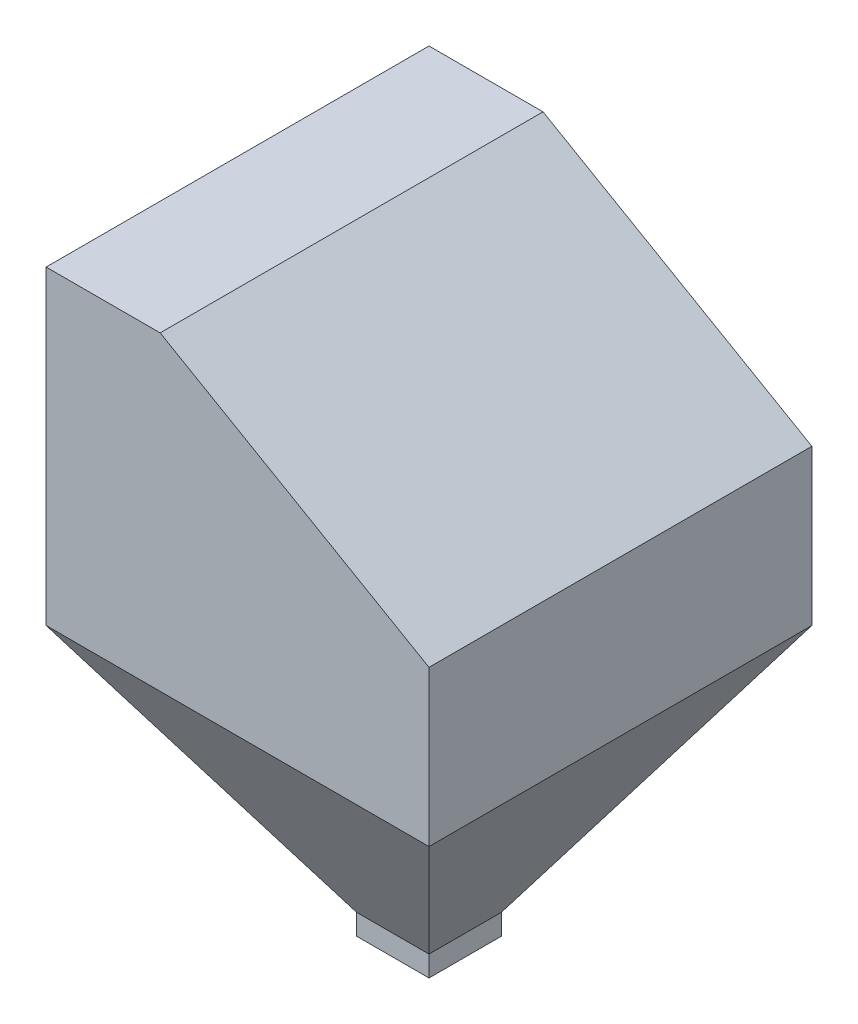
SolidWorks part; units mm, degrees
ref_plane "Front Plane" through (0, 0, 0) normal (0, 0, 1) x (1, 0, 0)
ref_plane "Top Plane" through (0, 0, 0) normal (0, 1, 0) x (1, 0, 0)
ref_plane "Right Plane" through (0, 0, 0) normal (1, 0, 0) x (0, 0, -1)
sketch "Sketch1" plane through (0, 0, 0) normal (0, 1, 0) x (1, 0, 0)
  line L1 (-87.5, -87.5) -> (87.5, -87.5)
  line L2 (-87.5, -87.5) -> (-87.5, 87.5)
  line L3 (-87.5, 87.5) -> (87.5, 87.5)
  line L4 (87.5, -87.5) -> (87.5, 87.5)
  line L5 (0, 87.5) -> (0, -87.5) construction
  line L6 (-87.5, 0) -> (87.5, 0) construction
  point P0 (0, 0)
  dimension "D1" = 175
ref_plane "Plane1" through (0, 600, 0) normal (0, 1, 0) x (1, 0, 0)
sketch "Sketch2" plane through (0, 600, 0) normal (0, 1, 0) x (1, 0, 0)
  line L1 (-462.5, -462.5) -> (462.5, -462.5)
  line L2 (-462.5, -462.5) -> (-462.5, 462.5)
  line L3 (-462.5, 462.5) -> (462.5, 462.5)
  line L4 (462.5, -462.5) -> (462.5, 462.5)
  line L5 (0, 462.5) -> (0, -462.5) construction
  line L6 (-462.5, 0) -> (462.5, 0) construction
  point P0 (0, 0)
  dimension "D1" = 925
loft "Loft1" add profiles "Sketch1", "Sketch2"
sketch "Sketch3" plane through (0, 600, 0) normal (0, 1, 0) x (1, 0, 0)
  line L4 (462.5, -462.5) -> (462.5, 462.5)
  line L5 (462.5, 462.5) -> (-462.5, 462.5)
  line L6 (-462.5, 462.5) -> (-462.5, -462.5)
  line L7 (-462.5, -462.5) -> (462.5, -462.5)
  line L8 (462.5, -462.5) -> (462.5, 462.5)
  line L9 (462.5, 462.5) -> (-462.5, 462.5)
  line L10 (-462.5, 462.5) -> (-462.5, -462.5)
  line L11 (-462.5, -462.5) -> (462.5, -462.5)
  dimension "D1" = 0
extrude "Boss-Extrude1" add sketch "Sketch3" along normal blind 750
sketch "Sketch4" plane through (0, 0, 462.5) normal (0, 0, 1) x (1, 0, 0)
  line L0 (462.5, 975) -> (-187.0191, 1350)
  line L1 (462.5, 1350) -> (462.5, 600) construction
  line L2 (-462.5, 1350) -> (462.5, 1350) construction
  dimension "D1" = 60
extrude "Cut-Extrude1" cut sketch "Sketch4" against normal through all and the other way through all flip side to cut
sketch "Sketch5" plane through (0, 0, 0) normal (0, -1, 0) x (1, 0, 0)
  line L4 (87.5, -87.5) -> (87.5, 87.5)
  line L5 (87.5, 87.5) -> (-87.5, 87.5)
  line L6 (-87.5, 87.5) -> (-87.5, -87.5)
  line L7 (-87.5, -87.5) -> (87.5, -87.5)
  line L8 (87.5, -87.5) -> (87.5, 87.5)
  line L9 (87.5, 87.5) -> (-87.5, 87.5)
  line L10 (-87.5, 87.5) -> (-87.5, -87.5)
  line L11 (-87.5, -87.5) -> (87.5, -87.5)
  dimension "D1" = 0
extrude "Boss-Extrude2" add sketch "Sketch5" along normal blind 50
